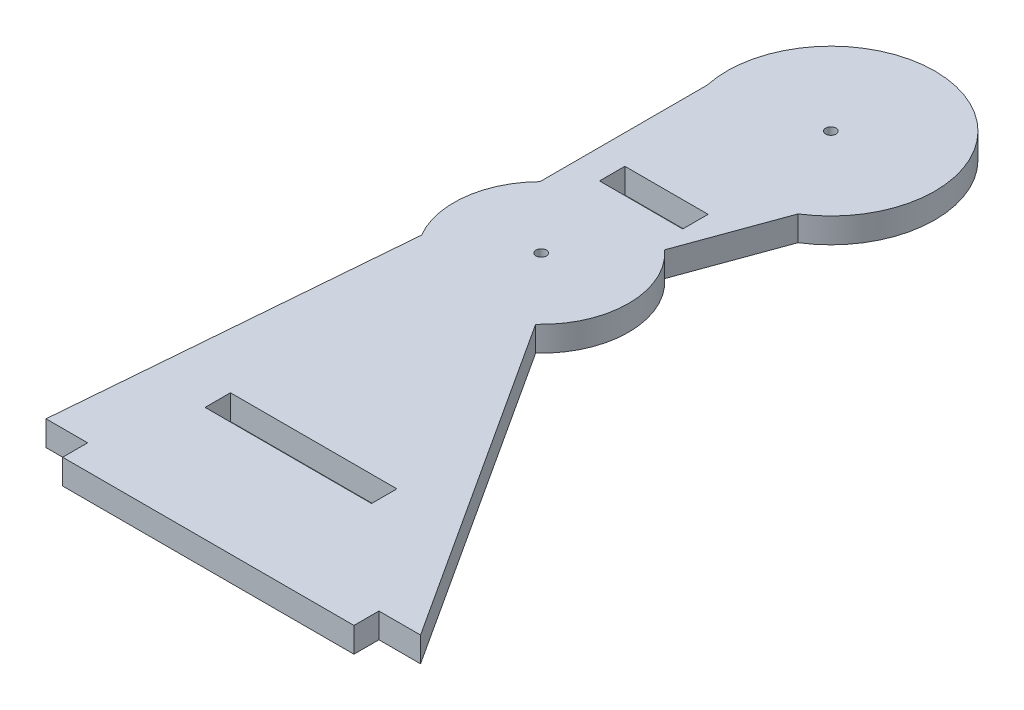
SolidWorks part; units mm, degrees
ref_plane "Ön Düzlem" through (0, 0, 0) normal (0, 0, 1) x (1, 0, 0)
ref_plane "Üst Düzlem" through (0, 0, 0) normal (0, 1, 0) x (1, 0, 0)
ref_plane "Sağ Düzlem" through (0, 0, 0) normal (1, 0, 0) x (0, 0, -1)
sketch "Çizim1" plane through (0, 0, 0) normal (0, 1, 0) x (1, 0, 0)
  line L0 (0, 0) -> (0, 6)
  line L1 (0, 6) -> (10, 6)
  line L2 (10, 6) -> (-40.8351, 84.4966)
  line L3 (-70, 0) -> (-70, 6)
  line L4 (-70, 6) -> (-80, 6)
  line L5 (-70, 0) -> (0, 0)
  line L6 (-80, 6) -> (-73.1006, 89.3526)
  line L7 (-40.8351, 115.5034) -> (-32.2846, 138.9957)
  line L9 (-70, 114.6969) -> (-70, 154.8559)
  line L11 (-55, 100) -> (-55, 0) construction
  line L13 (-63.2593, 33.5815) -> (-23.2593, 33.5815)
  line L14 (-63.2593, 33.5815) -> (-63.2593, 27.4815)
  line L15 (-63.2593, 27.4815) -> (-23.2593, 27.4815)
  line L16 (-23.2593, 33.5815) -> (-23.2593, 27.4815)
  line L20 (-63, 128.1) -> (-43, 128.1)
  line L21 (-63, 128.1) -> (-63, 122)
  line L22 (-63, 122) -> (-43, 122)
  line L23 (-43, 128.1) -> (-43, 122)
  line L24 (-63, 128.1) -> (-43, 122) construction
  line L25 (-63, 122) -> (-43, 128.1) construction
  arc A0 (-40.8351, 84.4966) -> (-40.8351, 115.5034) centre (-55, 100) ccw
  arc A1 (-70, 114.6969) -> (-73.1006, 89.3526) centre (-55, 100) ccw
  circle A4 centre (-55, 100) radius 1.25
  arc A5 (-32.2846, 138.9957) -> (-70, 154.8559) centre (-45.5718, 160.1723) ccw
  circle A6 centre (-45.5718, 160.1723) radius 1.25
  point P22 (-53, 125.05)
  point P27 (-63, 125.05)
  dimension "D6" = 42
  dimension "D7" = 100
  dimension "D20" = 2.5
  dimension "D13" = 50
  dimension "D14" = 2.5
  dimension "D1" = 70
  dimension "D2" = 6
  dimension "D3" = 6
  dimension "D4" = 10
  dimension "D5" = 10
  dimension "D8" = 15
  dimension "D9" = 40
  dimension "D10" = 6.1
  dimension "D11" = 6.1
  dimension "D12" = 25
  dimension "D15" = 20
  dimension "D16" = 6.1
  dimension "D17" = 7
  dimension "D18" = 122
extrude "Yükseklik-Ekstrüzyon1" add sketch "Çizim1" along normal blind 6
